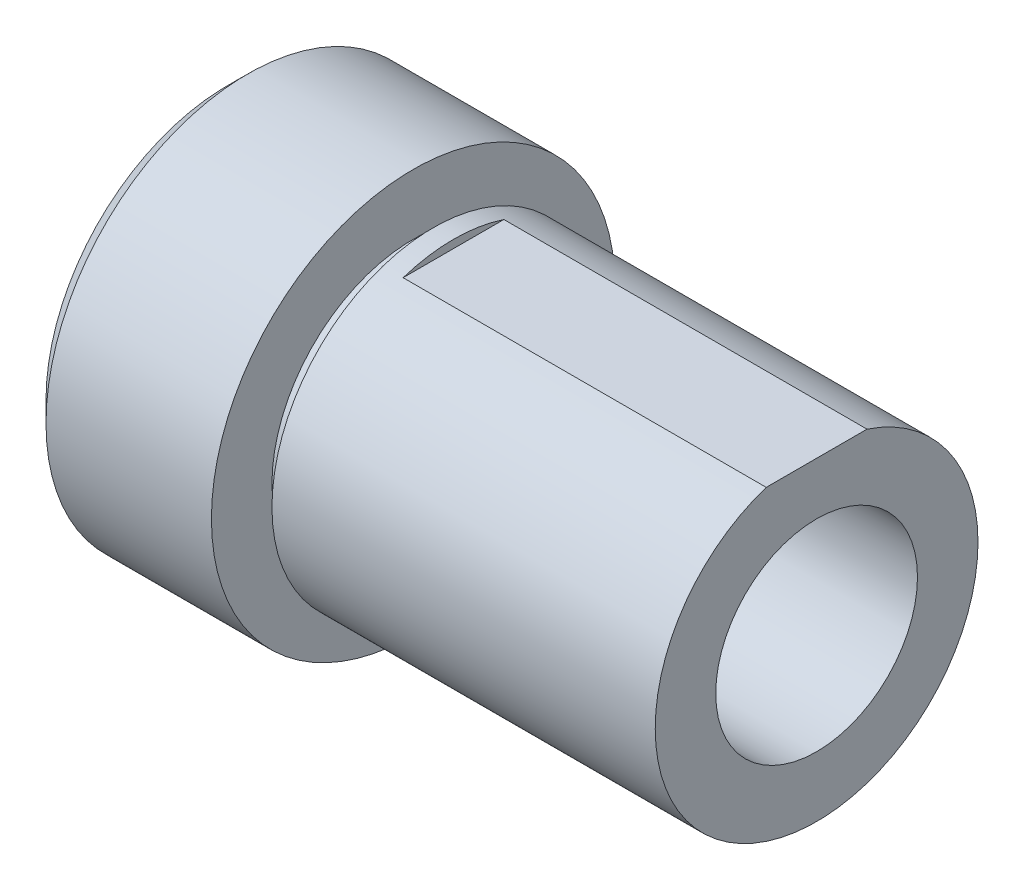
SolidWorks part; units mm, degrees
ref_plane "Front Plane" through (0, 0, 0) normal (0, 0, 1) x (1, 0, 0)
ref_plane "Top Plane" through (0, 0, 0) normal (0, 1, 0) x (1, 0, 0)
ref_plane "Right Plane" through (0, 0, 0) normal (1, 0, 0) x (0, 0, -1)
sketch "Sketch1" plane through (0, 0, 0) normal (1, 0, 0) x (0, 0, -1)
  circle A0 centre (0, 0) radius 5
  dimension "D1" = 10
extrude "Boss-Extrude1" add sketch "Sketch1" along normal blind 4.6
sketch "Sketch2" plane through (4.6, 0, 0) normal (1, 0, 0) x (0, 0, -1)
  circle A0 centre (0, 0) radius 4
  dimension "D1" = 8
extrude "Boss-Extrude2" add sketch "Sketch2" along normal blind 10
sketch "Sketch3" plane through (14.6, 0, 0) normal (1, 0, 0) x (0, 0, -1)
  circle A0 centre (0, 0) radius 2.5
  dimension "D1" = 5
extrude "Cut-Extrude1" cut sketch "Sketch3" against normal through all
chamfer "Chamfer1" distance 0.5 angle 45 1 edges at (0, 0, -5)
sketch "Sketch4" plane through (0, 0, 0) normal (0, 0, 1) x (1, 0, 0)
  line L0 (14.6, -4) -> (14.6, 4) construction
  line L1 (14.6, 3.8) -> (5.6, 3.8)
  line L2 (14.6, 3.8) -> (14.6, 4)
  line L3 (14.6, 4) -> (5.6, 4)
  line L4 (5.6, 3.8) -> (5.6, 4)
  dimension "D1" = 9
  dimension "D2" = 0.2
extrude "Cut-Extrude2" cut sketch "Sketch4" against normal mid plane 10
sketch "Sketch5" plane through (0, 0, 0) normal (0, 0, 1) x (1, 0, 0)
  line L0 (5.6, 4) -> (4.6, 4) construction
  line L1 (5.1, 4) -> (4.6, 4)
  line L2 (5.1, 4) -> (5.1, 3.5)
  line L3 (5.1, 3.5) -> (4.6, 3.5)
  line L4 (4.6, 4) -> (4.6, 3.5)
  line L5 (4.6, -5) -> (4.6, 5) construction
  dimension "D1" = 0.5
  dimension "D2" = 0.5
revolve "Cut-Revolve2" cut sketch "Sketch5" angle 360 about axis through (4.6, 0, 0) along (-1, 0, 0)
